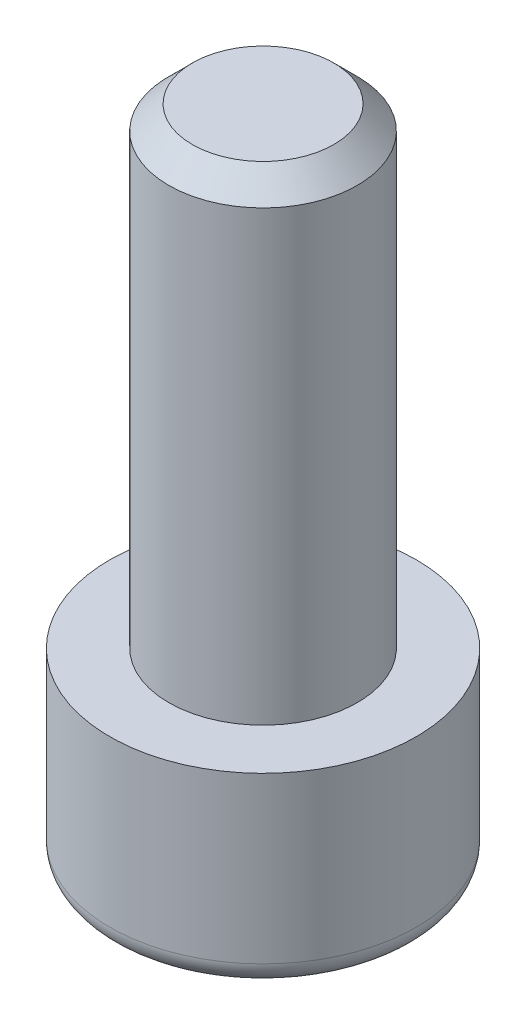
SolidWorks part; units mm, degrees
ref_plane "Plan de face" through (0, 0, 0) normal (0, 0, 1) x (1, 0, 0)
ref_plane "Plan de dessus" through (0, 0, 0) normal (0, 1, 0) x (1, 0, 0)
ref_plane "Plan de droite" through (0, 0, 0) normal (1, 0, 0) x (0, 0, -1)
sketch "Esquisse1" plane through (0, 0, 0) normal (0, 1, 0) x (1, 0, 0)
  circle A0 centre (0, 0) radius 4
  dimension "D1" = 8
extrude "Extrusion1" add sketch "Esquisse1" along normal blind 20
chamfer "Chanfrein1" distance 1 angle 45 1 edges at (0, 20, 4)
sketch "Esquisse2" plane through (0, 0, 0) normal (0, -1, 0) x (1, 0, 0)
  circle A0 centre (0, 0) radius 6.5
  dimension "D1" = 13
extrude "Extrusion2" add sketch "Esquisse2" along normal blind 8
fillet "Congé1" radius 1 1 edges at (0, -8, -6.5)
sketch "Esquisse3" plane through (0, -8, 0) normal (0, -1, 0) x (1, 0, 0)
  line L0 (-3, 1.7292) -> (0, 3.45)
  line L1 (0, 3.45) -> (3, 1.7292)
  line L2 (3, 1.7292) -> (3, -1.7292)
  line L3 (3, -1.7292) -> (0, -3.45)
  line L4 (0, -3.45) -> (-3, -1.7292)
  line L5 (-3, -1.7292) -> (-3, 1.7292)
  line L6 (0, 3.45) -> (0, -3.45) construction
  line L7 (-3, 0) -> (3, 0) construction
  dimension "D1" = 6
  dimension "D2" = 6.9
extrude "Enlèv. mat.-Extru.1" cut sketch "Esquisse3" against normal blind 6
